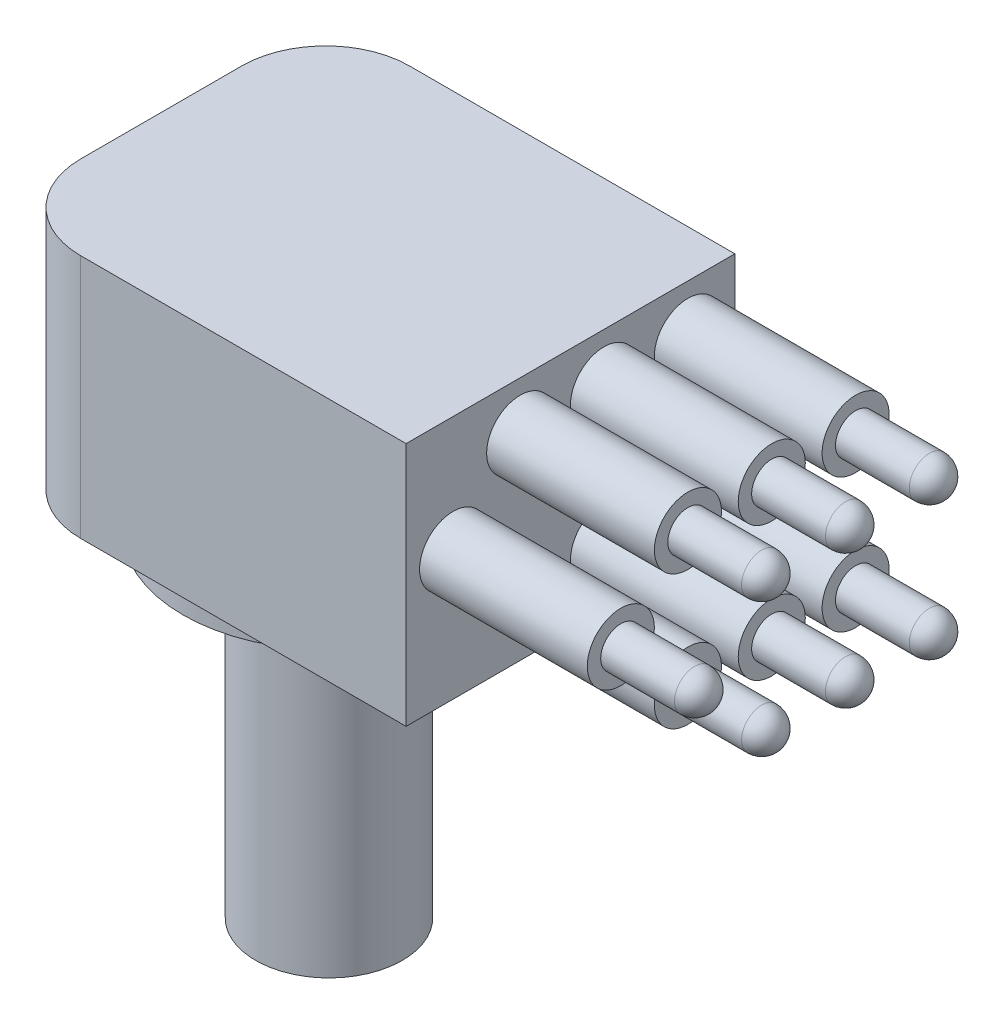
SolidWorks part; units mm, degrees
ref_plane "Plane1" through (0, 0, 0) normal (0, 0, 1) x (1, 0, 0)
ref_plane "Plane2" through (0, 0, 0) normal (0, 1, 0) x (1, 0, 0)
ref_plane "Plane3" through (0, 0, 0) normal (1, 0, 0) x (0, 0, -1)
sketch "Sketch1" plane through (0, 0, 0) normal (0, 0, 1) x (1, 0, 0)
  line L1 (0, 0) -> (30.988, 0)
  line L2 (0, 0) -> (0, 18.542)
  line L3 (0, 18.542) -> (30.988, 18.542)
  line L4 (30.988, 0) -> (30.988, 18.542)
  dimension "D1" = 30.988
  dimension "D2" = 18.542
extrude "Base-Extrude" add sketch "Sketch1" along normal blind 24.892
sketch "Sketch2" plane through (0, 0, 0) normal (0, -1, 0) x (1, 0, 0)
  line L0 (0, 24.892) -> (30.988, 24.892) construction
  line L1 (0, 24.892) -> (0, 0) construction
  circle A0 centre (12.7, 12.446) radius 11.049
  dimension "D1" = 22.098
  dimension "D2" = 12.446
  dimension "D3" = 12.7
extrude "Boss-Extrude1" add sketch "Sketch2" along normal blind 2.54
sketch "Sketch3" plane through (0, -2.54, 0) normal (0, -1, 0) x (1, 0, 0)
  circle A0 centre (12.7, 12.446) radius 5.5562
  circle A1 centre (12.7, 12.446) radius 11.049 construction
  dimension "D1" = 11.1125
extrude "Boss-Extrude2" add sketch "Sketch3" along normal blind 25.4
fillet "Fillet3" radius 6.35
sketch "Sketch4" plane through (30.988, 0, 0) normal (1, 0, 0) x (0, 0, -1)
  line L0 (-24.892, 0) -> (0, 0) construction
  line L1 (-24.892, 0) -> (-24.892, 18.542) construction
  circle A0 centre (-21.336, 9.779) radius 2.54
  circle A1 centre (-16.256, 14.859) radius 2.54
  circle A2 centre (-9.906, 14.859) radius 2.54
  circle A3 centre (-3.556, 14.859) radius 2.54
  circle A4 centre (-16.256, 4.699) radius 2.54
  circle A5 centre (-9.906, 4.699) radius 2.54
  circle A6 centre (-3.556, 4.699) radius 2.54
  dimension "D3" = 5.08
  dimension "D1" = 9.779
  dimension "D2" = 3.556
extrude "Boss-Extrude3" add sketch "Sketch4" along normal blind 12.7
sketch "Sketch5" plane through (43.688, 0, 0) normal (1, 0, 0) x (0, 0, -1)
  circle A0 centre (-21.336, 9.779) radius 1.524
  circle A1 centre (-21.336, 9.779) radius 2.54 construction
  circle A2 centre (-16.256, 14.859) radius 1.524
  circle A3 centre (-9.906, 14.859) radius 1.524
  circle A4 centre (-3.556, 14.859) radius 1.524
  circle A5 centre (-16.256, 4.699) radius 1.524
  circle A6 centre (-9.906, 4.699) radius 1.524
  circle A7 centre (-3.556, 4.699) radius 1.524
  dimension "D1" = 3.048
extrude "Boss-Extrude4" add sketch "Sketch5" along normal blind 7.112
fillet "Fillet5" radius 1.524
